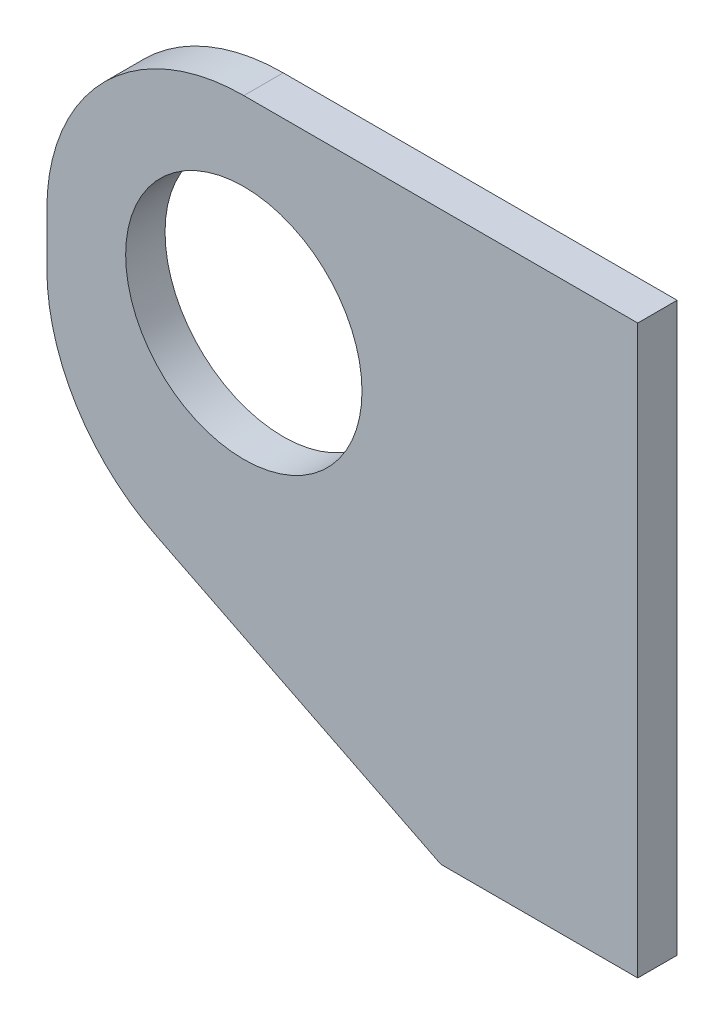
SolidWorks part; units mm, degrees
ref_plane "Front Plane" through (0, 0, 0) normal (0, 0, 1) x (1, 0, 0)
ref_plane "Top Plane" through (0, 0, 0) normal (0, 1, 0) x (1, 0, 0)
ref_plane "Right Plane" through (0, 0, 0) normal (1, 0, 0) x (0, 0, -1)
sketch "Sketch1" plane through (0, 0, 0) normal (0, 0, 1) x (1, 0, 0)
  line L0 (0, 0) -> (0, 144)
  line L3 (0, 144) -> (-150, 144)
  line L4 (-150, 144) -> (-150, 50)
  line L5 (-150, 50) -> (-50, 0)
  line L6 (-50, 0) -> (0, 0)
  circle A0 centre (-100, 94) radius 30
  dimension "D5" = 60
  dimension "D1" = 144
  dimension "D2" = 50
  dimension "D3" = 150
  dimension "D6" = 50
  dimension "D7" = 50
  dimension "D8" = 100
extrude "Boss-Extrude1" add sketch "Sketch1" along normal mid plane 10
fillet "Fillet1" radius 50 2 edges at (-150, 144, 0) (-150, 50, 0)
